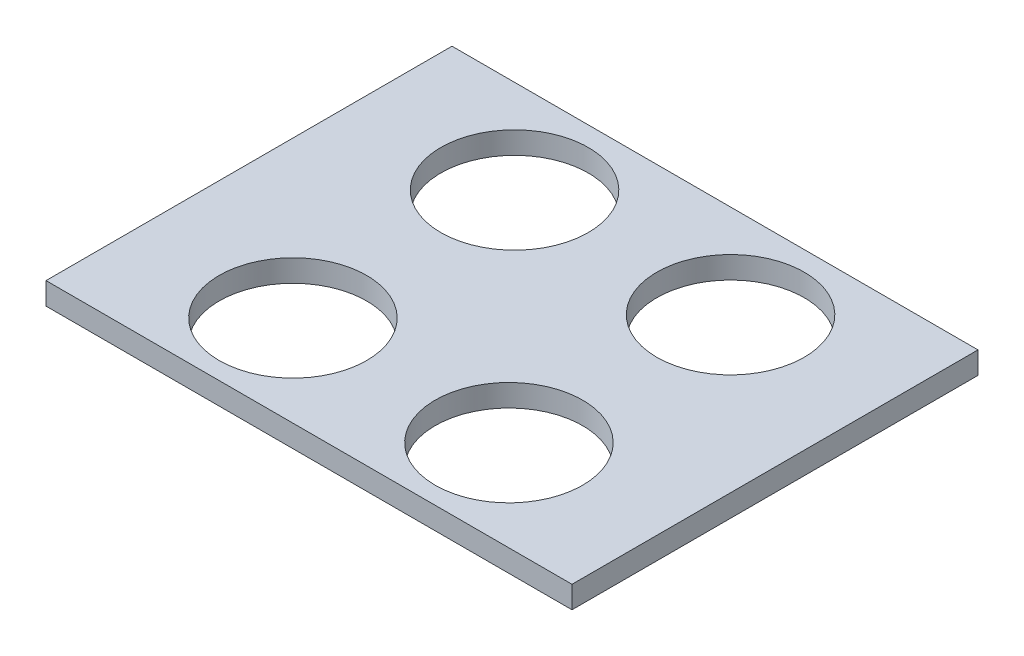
SolidWorks part; units mm, degrees
ref_plane "前视基准面" through (0, 0, 0) normal (0, 0, 1) x (1, 0, 0)
ref_plane "上视基准面" through (0, 0, 0) normal (0, 1, 0) x (1, 0, 0)
ref_plane "右视基准面" through (0, 0, 0) normal (1, 0, 0) x (0, 0, -1)
sketch "草图3" plane through (0, 0, 0) normal (0, 1, 0) x (1, 0, 0)
  line L0 (-32.3739, 26.8171) -> (38.9526, 26.8171)
  line L1 (38.9526, 26.8171) -> (38.9526, -28.2359)
  line L2 (38.9526, -28.2359) -> (-32.3739, -28.2359)
  line L3 (-32.3739, -28.2359) -> (-32.3739, 26.8171)
extrude "凸台-拉伸1" add sketch "草图3" along normal blind 3
sketch "草图9" plane through (0, 3, 0) normal (0, 1, 0) x (1, 0, 0)
  circle A0 centre (-11.2437, 14.169) radius 10
  circle A1 centre (18.0455, 14.169) radius 10
  circle A2 centre (18.0455, -15.8842) radius 10
  circle A3 centre (-11.2437, -15.8842) radius 10
  point P8 (0, 0)
  point P9 (0, 0)
  point P10 (0, 0)
  point P11 (0, 0)
  point P12 (0, 0)
  point P13 (0, 0)
extrude "切除-拉伸2" cut sketch "草图9" against normal blind 3
